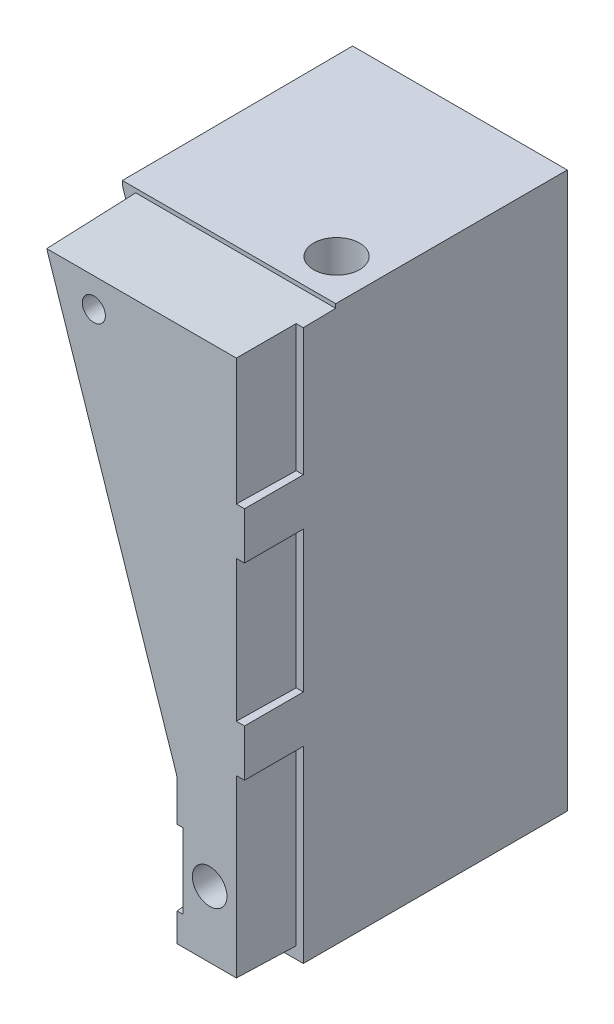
SolidWorks part; units mm, degrees
ref_plane "Plan de face" through (0, 0, 0) normal (0, 0, 1) x (1, 0, 0)
ref_plane "Plan de dessus" through (0, 0, 0) normal (0, 1, 0) x (1, 0, 0)
ref_plane "Plan de droite" through (0, 0, 0) normal (1, 0, 0) x (0, 0, -1)
imported_body "Importée1"
sketch "Esquisse1" plane through (0, 0, 0) normal (0, 0, 1) x (1, 0, 0)
  circle A0 centre (-32, 33.9925) radius 3 construction
  circle A1 centre (-32, 33.9925) radius 3
  circle A2 centre (-32, 33.9925) radius 2
  dimension "D1" = 4
extrude "Extrusion1" add sketch "Esquisse1" against normal up to surface (56 mm away)
